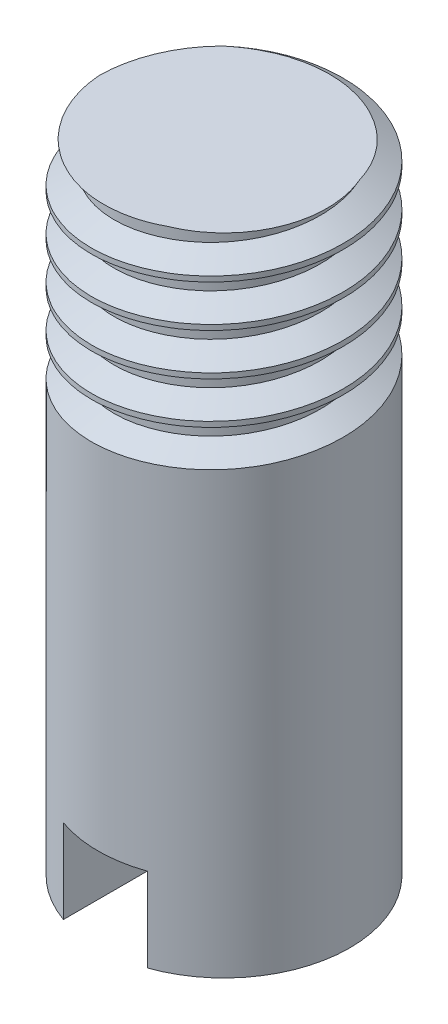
SolidWorks part; units mm, degrees
ref_plane "Front" through (0, 0, 0) normal (0, 0, 1) x (1, 0, 0)
ref_plane "Top" through (0, 0, 0) normal (0, 1, 0) x (1, 0, 0)
ref_plane "Right" through (0, 0, 0) normal (1, 0, 0) x (0, 0, -1)
sketch "Esquisse1" plane through (0, 0, 0) normal (0, 1, 0) x (1, 0, 0)
  circle A0 centre (0, 0) radius 1.5
  dimension "D1" = 3
extrude "Boss.-Extru.1" add sketch "Esquisse1" along normal blind 7.5
sketch "Esquisse3" plane through (0, 0, 0) normal (0, 0, 1) x (1, 0, 0)
  line L0 (-1.5, 0) -> (1.5, 0) construction
  line L1 (-0.5, -1) -> (0.5, -1)
  line L2 (-0.5, -1) -> (-0.5, 1)
  line L3 (-0.5, 1) -> (0.5, 1)
  line L4 (0.5, -1) -> (0.5, 1)
  line L5 (-0.5, -1) -> (0.5, 1) construction
  line L6 (-0.5, 1) -> (0.5, -1) construction
  point P0 (0, 0)
  dimension "D1" = 1
  dimension "D2" = 1
extrude "Enlèv. mat.-Extru.1" cut sketch "Esquisse3" against normal up to next and the other way up to next
thread "Filetage1" pitch 0.5 start angle 0, offset 1, length 3, pitch 0.5, diameter 3
ref_plane "Plan1" through (-1.5, 8.5, 0) normal (0, 0, 1) x (-1, 0, 0)
sketch "Profil de filetage1" plane through (-1.5, 8.5, 0) normal (0, 0, 1) x (-1, 0, 0)
  line L0 (0, 0) -> (0, 0.5) construction
  line L11 (0, 0) -> (0, 0.4375)
  line L12 (0, 0.4375) -> (-0.2706, 0.2812)
  line L13 (-0.2706, 0.2812) -> (-0.2706, 0.1562)
  line L15 (-0.2706, 0.1562) -> (0, 0)
  line L17 (-0.2706, 0.2187) -> (0, 0.2187) construction
  point P2 (0, 0)
  dimension "Pitch" = 0.5
  dimension "Profile_Angle" = 60
  dimension "Profile_Land" = 0.125
  dimension "Profile_Height" = 0.2706
